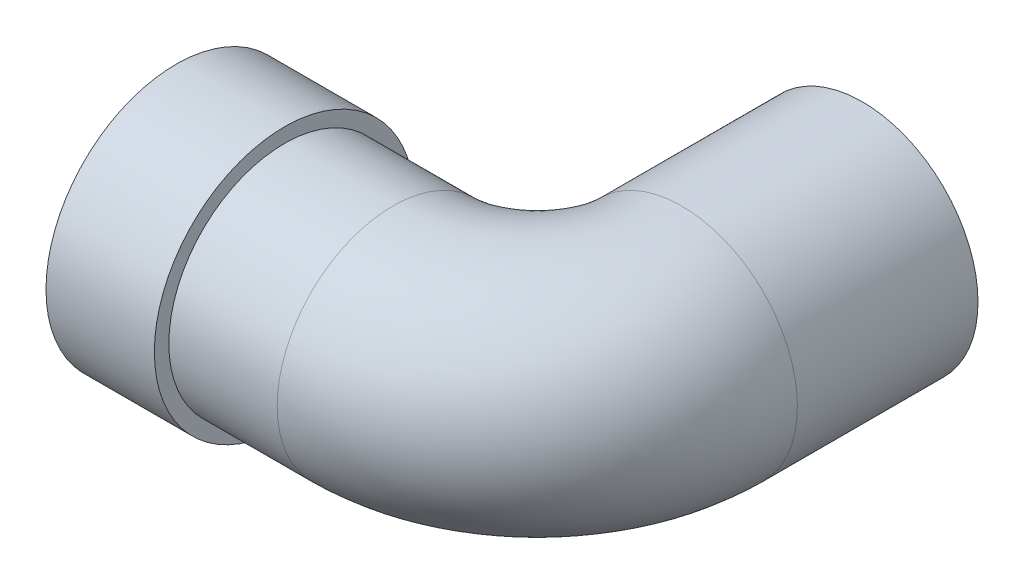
SolidWorks part; units mm, degrees
ref_plane "Plan de face" through (0, 0, 0) normal (0, 0, 1) x (1, 0, 0)
ref_plane "Plan de dessus" through (0, 0, 0) normal (0, 1, 0) x (1, 0, 0)
ref_plane "Plan de droite" through (0, 0, 0) normal (1, 0, 0) x (0, 0, -1)
sketch "Esquisse1" plane through (0, 0, 0) normal (0, 0, 1) x (1, 0, 0)
  circle A0 centre (0, 0) radius 16
  circle A1 centre (0, 0) radius 14
  dimension "D1" = 32
  dimension "D2" = 28
sketch "Esquisse2" plane through (0, 0, 0) normal (0, 1, 0) x (1, 0, 0)
  line L0 (0, 0) -> (0, -25)
  line L1 (-20, -45) -> (-40, -45)
  arc A0 (0, -25) -> (-20, -45) centre (-20, -25) cw
  point P6 (0, -45)
  dimension "D3" = 20
  dimension "D1" = 45
  dimension "D2" = 40
sweep "Balayage7" add profiles "Esquisse1" path "Esquisse2"
sketch "Esquisse4" plane through (-40, 0, 0) normal (-1, 0, 0) x (0, 0, 1)
  circle A0 centre (45, 0) radius 18
  circle A1 centre (45, 0) radius 16 construction
  circle A2 centre (45, 0) radius 16
  dimension "D1" = 36
extrude "Boss.-Extru.2" add sketch "Esquisse4" along normal blind 10 and the other way blind 5
